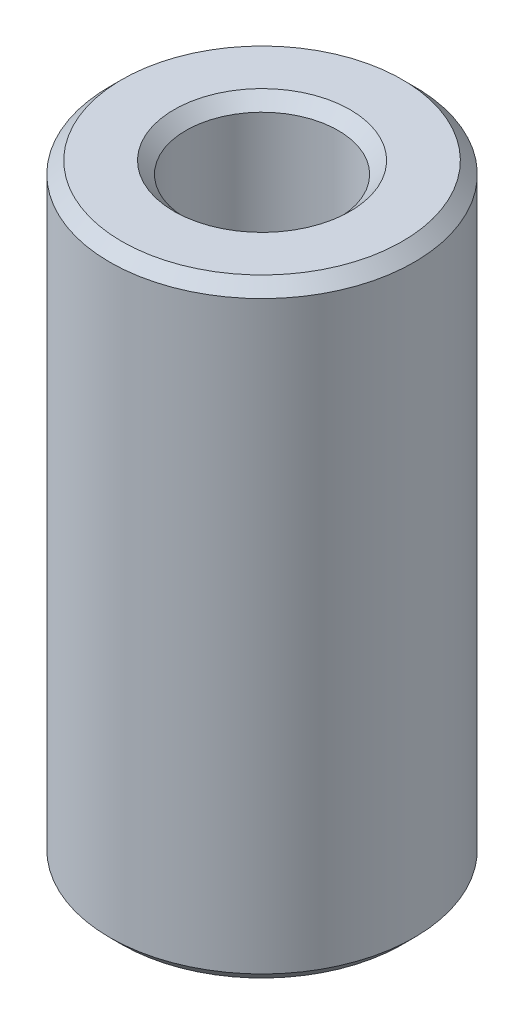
SolidWorks part; units mm, degrees
ref_plane "Front Plane" through (0, 0, 0) normal (0, 0, 1) x (1, 0, 0)
ref_plane "Top Plane" through (0, 0, 0) normal (0, 1, 0) x (1, 0, 0)
ref_plane "Right Plane" through (0, 0, 0) normal (1, 0, 0) x (0, 0, -1)
sketch "Sketch1" plane through (0, 0, 0) normal (0, 1, 0) x (1, 0, 0)
  circle A0 centre (0, 0) radius 6.35
  circle A1 centre (0, 0) radius 3.175
  point P3 (0, 0)
  dimension "D1" = 12.7
  dimension "D2" = 3.175
extrude "Boss-Extrude1" add sketch "Sketch1" along normal blind 25.4
chamfer "Chamfer1" distance 0.5 angle 45 4 edges at (0, 0, 6.35) (0, 0, 3.175) (0, 25.4, 6.35) (0, 25.4, 3.175)
